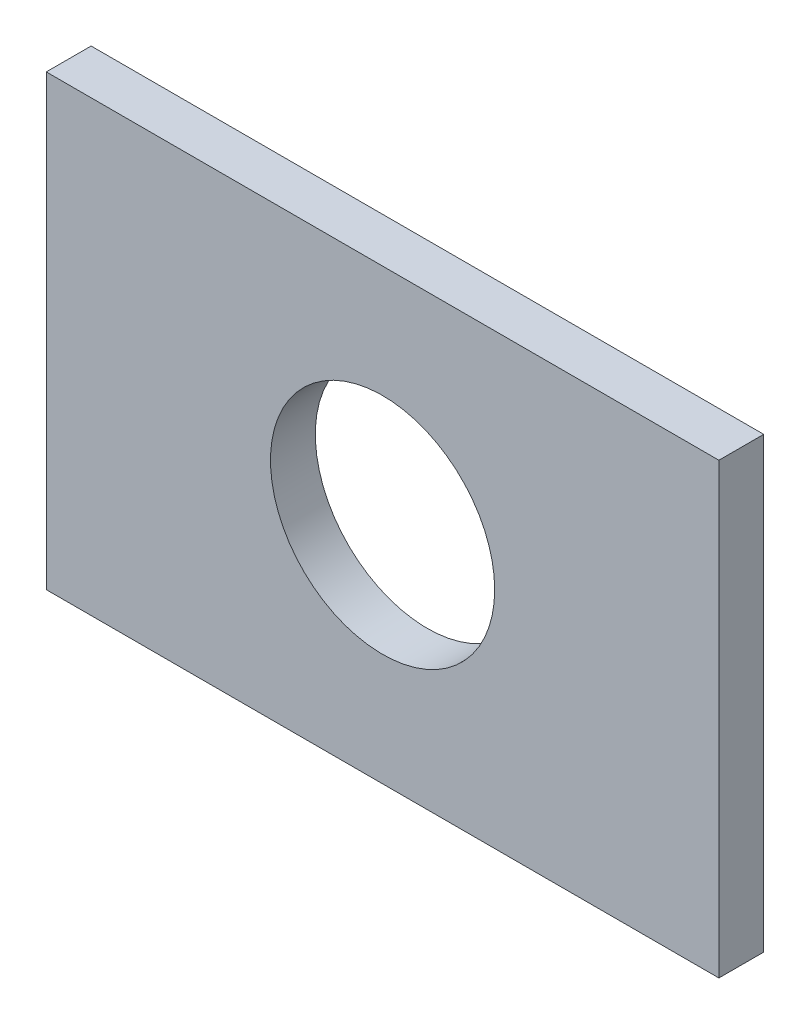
SolidWorks part; units mm, degrees
ref_plane "Front Plane" through (0, 0, 0) normal (0, 0, 1) x (1, 0, 0)
ref_plane "Top Plane" through (0, 0, 0) normal (0, 1, 0) x (1, 0, 0)
ref_plane "Right Plane" through (0, 0, 0) normal (1, 0, 0) x (0, 0, -1)
sketch "Sketch1" plane through (0, 0, 0) normal (0, 0, 1) x (1, 0, 0)
  line L1 (-75, 50) -> (75, 50)
  line L2 (-75, 50) -> (-75, -50)
  line L3 (-75, -50) -> (75, -50)
  line L4 (75, 50) -> (75, -50)
  line L5 (-75, 50) -> (75, -50) construction
  line L6 (-75, -50) -> (75, 50) construction
  point P0 (0, 0)
  dimension "D1" = 100
  dimension "D2" = 150
extrude "Boss-Extrude1" add sketch "Sketch1" along normal blind 10
sketch "Sketch2" plane through (0, 0, 10) normal (0, 0, 1) x (1, 0, 0)
  circle A0 centre (0, 0) radius 32.5
  dimension "D1" = 65
extrude "Cut-Extrude1" [suppressed] cut sketch "Sketch2" against normal blind 10
sketch "Sketch3" plane through (0, 0, 10) normal (0, 0, 1) x (1, 0, 0)
  circle A0 centre (0, 0) radius 25
  dimension "D1" = 50
extrude "Cut-Extrude2" cut sketch "Sketch3" against normal blind 10 contours A0
